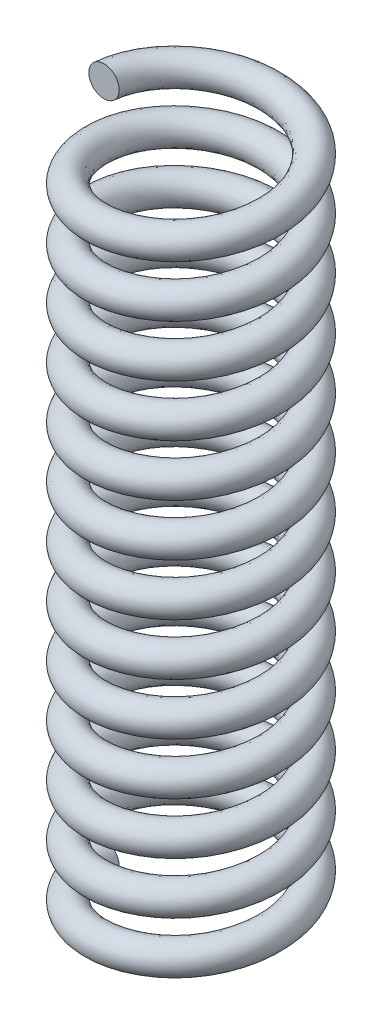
SolidWorks part; units mm, degrees
ref_plane "Front Plane" through (0, 0, 0) normal (0, 0, 1) x (1, 0, 0)
ref_plane "Top Plane" through (0, 0, 0) normal (0, 1, 0) x (1, 0, 0)
ref_plane "Right Plane" through (0, 0, 0) normal (1, 0, 0) x (0, 0, -1)
sketch "Sketch1" plane through (0, 0, 0) normal (0, 0, 1) x (1, 0, 0)
  line L0 (0, 12.582) -> (0, -2.0284)
  line L1 (-1.143, -2.0284) -> (1.143, -2.0284) construction
  line L3 (-1.9304, 12.582) -> (1.9304, 12.582) construction
sketch "Sketch2" plane through (0, 0, 0) normal (0, 0, 1) x (1, 0, 0)
  line L0 (0, 12.582) -> (0, -2.0284) construction
  circle A0 centre (-1.8923, 12.582) radius 0.3302
  point P2 (-2.2225, 12.582)
  dimension "D1" = 0.6604
  dimension "D2" = 1.8923
sweep "Sweep1" add profiles "Sketch2" path "Sketch1" parameters "D1"=4680
sketch "Sketch3" plane through (0, 0, 0) normal (0, 1, 0) x (1, 0, 0)
  circle A0 centre (0, 0) radius 3.3299 construction
